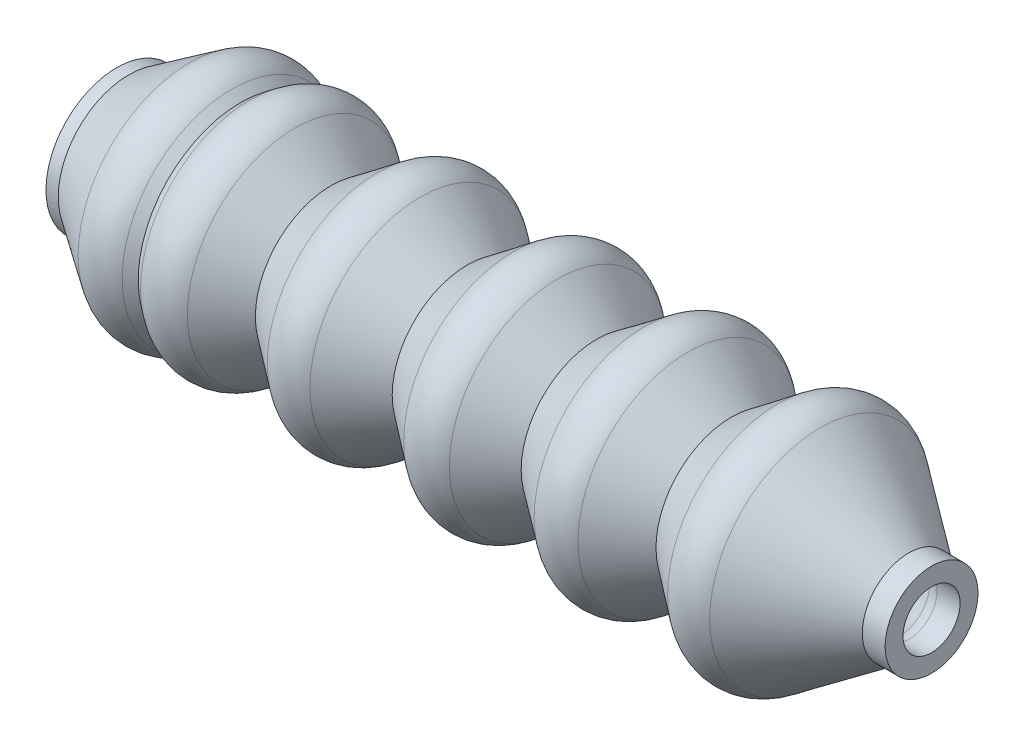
SolidWorks part; units mm, degrees
ref_plane "Plan1" through (0, 0, 0) normal (0, 0, 1) x (1, 0, 0)
ref_plane "Plan2" through (0, 0, 0) normal (0, 1, 0) x (1, 0, 0)
ref_plane "Plan3" through (0, 0, 0) normal (1, 0, 0) x (0, 0, -1)
sketch "Esquisse1" plane through (0, 0, 0) normal (0, 0, 1) x (1, 0, 0)
  line L0 (205.792, 156.1501) -> (205.792, 157.6261)
  line L1 (213.9751, 154.9473) -> (215.2944, 155.9275)
  line L2 (228.5673, 157.6261) -> (205.792, 157.6261)
  line L3 (205.792, 157.6261) -> (228.5673, 157.6261) construction
  line L210 (206.4139, 156.0652) -> (208.1049, 154.9302)
  line L217 (206.1353, 156.1501) -> (205.792, 156.1501)
  line L222 (210.4455, 154.9941) -> (211.456, 155.8829)
  line L226 (208.6958, 154.9549) -> (208.9446, 155.1538)
  line L227 (209.5568, 155.1634) -> (209.8154, 154.9695)
  line L233 (212.0844, 155.9089) -> (213.3787, 154.9473)
  line L407 (217.7966, 154.9815) -> (218.8866, 155.898)
  line L409 (215.8926, 155.9261) -> (217.1748, 154.9642)
  line L415 (219.5029, 155.9194) -> (220.8358, 154.948)
  line L417 (221.438, 154.958) -> (222.6631, 155.9145)
  line L425 (225.1618, 154.9419) -> (227.6357, 156.7332)
  line L427 (223.2709, 155.9204) -> (224.5685, 154.947)
  line L432 (227.9289, 156.8282) -> (228.5673, 156.8282)
  line L436 (228.5673, 156.8282) -> (228.5673, 157.6261)
  arc A24 (206.4139, 156.0652) -> (206.1353, 156.1501) centre (206.1353, 155.6501) ccw
  arc A26 (208.1049, 154.9302) -> (208.6958, 154.9549) centre (208.3836, 155.3454) ccw
  arc A27 (209.8154, 154.9695) -> (210.4455, 154.9941) centre (210.1153, 155.3696) ccw
  arc A28 (209.5568, 155.1634) -> (208.9446, 155.1538) centre (209.2569, 154.7633) ccw
  arc A32 (213.3787, 154.9473) -> (213.9751, 154.9473) centre (213.6769, 155.3487) ccw
  arc A33 (212.0844, 155.9089) -> (211.456, 155.8829) centre (211.7863, 155.5075) ccw
  arc A54 (223.2709, 155.9204) -> (222.6631, 155.9145) centre (222.9709, 155.5205) ccw
  arc A56 (219.5029, 155.9194) -> (218.8866, 155.898) centre (219.2084, 155.5153) ccw
  arc A57 (217.1748, 154.9642) -> (217.7966, 154.9815) centre (217.4748, 155.3642) ccw
  arc A58 (215.8926, 155.9261) -> (215.2944, 155.9275) centre (215.5926, 155.5261) ccw
  arc A61 (220.8358, 154.948) -> (221.438, 154.958) centre (221.1303, 155.3521) ccw
  arc A63 (224.5685, 154.947) -> (225.1618, 154.9419) centre (224.8686, 155.3469) ccw
  arc A66 (227.9289, 156.8282) -> (227.6357, 156.7332) centre (227.9289, 156.3282) ccw
  point P5 (205.792, 157.6261)
revolve "Base-Révolution" add sketch "Esquisse1" angle 360 about L3
shell "Coque3" thickness 0.5
scale "Echelle4"
scale "Echelle5"
